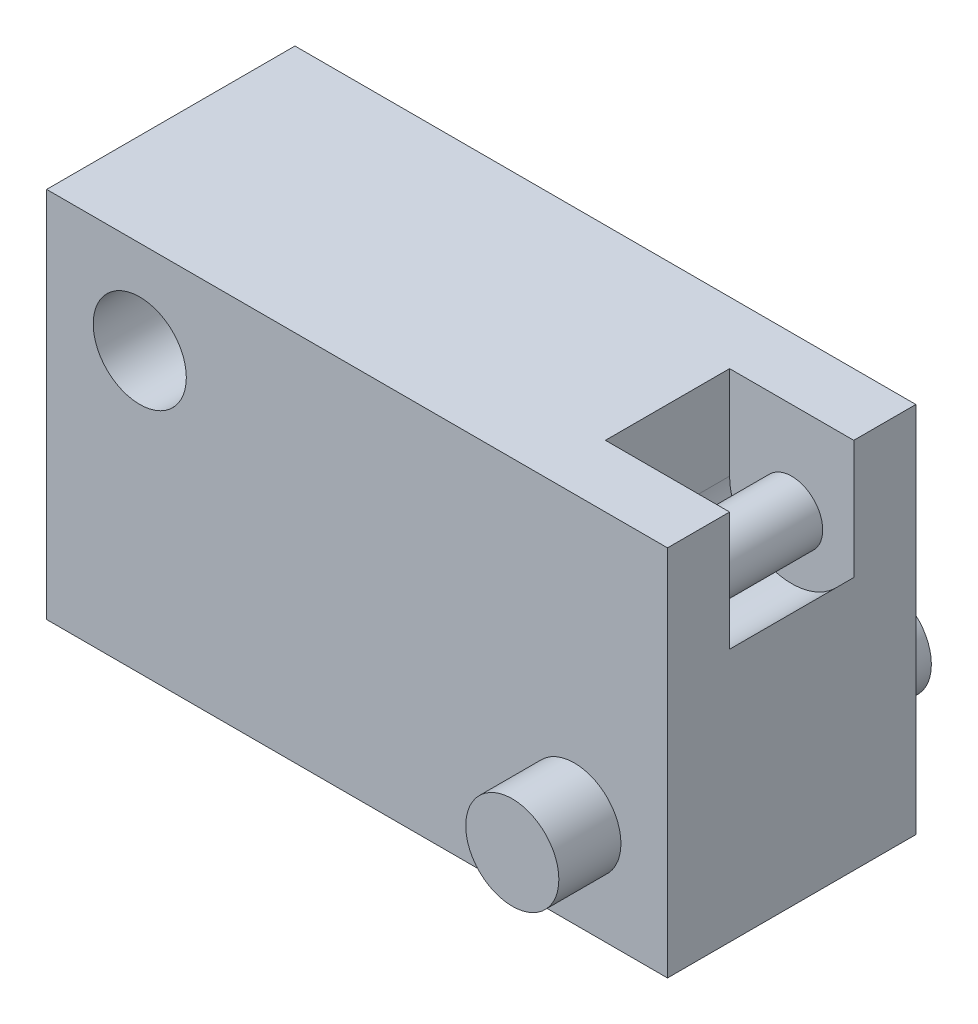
SolidWorks part; units mm, degrees
ref_plane "Face" through (0, 0, 0) normal (0, 0, 1) x (1, 0, 0)
ref_plane "Dessus" through (0, 0, 0) normal (0, 1, 0) x (1, 0, 0)
ref_plane "Droite" through (0, 0, 0) normal (1, 0, 0) x (0, 0, -1)
sketch "Esquisse1" plane through (0, 0, 0) normal (0, 0, 1) x (1, 0, 0)
  line L0 (0, 0) -> (5, 0) construction
  line L1 (-5, 3) -> (5, 3)
  line L2 (-5, 3) -> (-5, -3)
  line L3 (-5, -3) -> (5, -3)
  line L4 (5, 3) -> (5, -3)
  line L5 (0, 0) -> (0, -3) construction
  dimension "D1" = 10
  dimension "D2" = 6
extrude "Prisme de base" add sketch "Esquisse1" along normal mid plane 4
sketch "Esquisse2" plane through (0, 0, 0) normal (0, 0, 1) x (1, 0, 0)
  line L0 (5, -3) -> (5, 3) construction
  line L1 (-5, -3) -> (5, -3) construction
  circle A0 centre (3.5, -1.5) radius 0.75
  dimension "D1" = 1.5
  dimension "D2" = 1.5
  dimension "D3" = 1.5
extrude "Pions" add sketch "Esquisse2" along normal mid plane 6
sketch "Esquisse3" plane through (0, 0, 0) normal (0, 0, 1) x (1, 0, 0)
  line L0 (5, 3) -> (-5, 3) construction
  line L1 (-5, 3) -> (-5, -3) construction
  circle A0 centre (-3.5, 1.5) radius 0.75
  dimension "D1" = 1.5
  dimension "D2" = 1.5
  dimension "D3" = 1.5
extrude "Trou" cut sketch "Esquisse3" against normal through all and the other way through all
sketch "Esquisse4" plane through (0, 0, 0) normal (0, 0, 1) x (1, 0, 0)
  line L0 (3, 3) -> (3, 1.5)
  line L1 (5, 3) -> (-5, 3) construction
  line L2 (4.7071, 0.7929) -> (5, 1.0858)
  line L3 (5, -3) -> (5, 3) construction
  line L4 (3, 3) -> (5, 3)
  line L5 (5, 3) -> (5, 1.0858)
  arc A0 (3, 1.5) -> (4.7071, 0.7929) centre (4, 1.5) ccw
  circle A1 centre (4, 1.5) radius 0.5
  dimension "D1" = 1
  dimension "D4" = 1
  dimension "D2" = 1
  dimension "D3" = 1.5
  dimension "D5" = 45
extrude "Passage levier" cut sketch "Esquisse4" against normal mid plane 2
